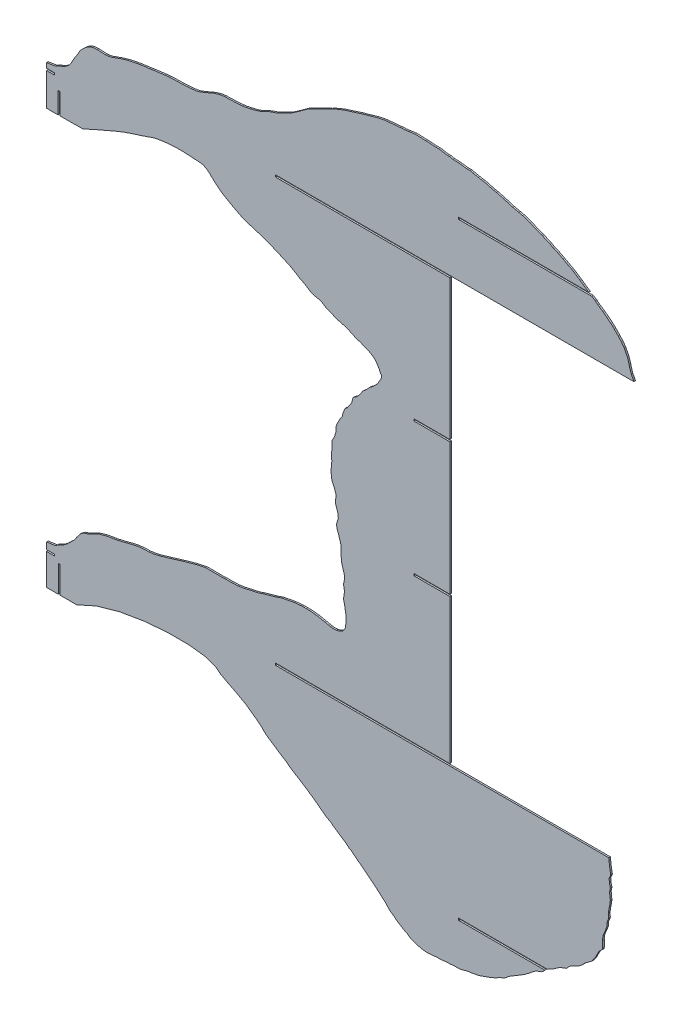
SolidWorks part; units mm, degrees
ref_plane "Спереди" through (0, 0, 0) normal (0, 0, 1) x (1, 0, 0)
ref_plane "Сверху" through (0, 0, 0) normal (0, 1, 0) x (1, 0, 0)
ref_plane "Справа" through (0, 0, 0) normal (1, 0, 0) x (0, 0, -1)
sketch "Model" plane through (0, 0, 0) normal (0, 0, 1) x (1, 0, 0)
  line L0 (-3659.4088, 337.2623) -> (-3649.3155, 337.2623)
  line L1 (-3649.3155, 337.2623) -> (-3649.3155, 339.2623)
  line L2 (-3649.3155, 339.2623) -> (-3659.4088, 339.2623)
  line L3 (-3659.4088, 339.2623) -> (-3659.4088, 347.0727)
  line L4 (-3659.4088, 347.0727) -> (-3659.15, 347.5463)
  line L5 (-3659.15, 347.5463) -> (-3647.8631, 349.1225)
  line L6 (-3647.8631, 349.1225) -> (-3646.4682, 350.2928)
  line L7 (-3646.4682, 350.2928) -> (-3646.1801, 350.5755)
  line L8 (-3646.1801, 350.5755) -> (-3644.035, 351.8111)
  line L9 (-3644.035, 351.8111) -> (-3640.8509, 353.3027)
  line L10 (-3640.8509, 353.3027) -> (-3638.1073, 355.0172)
  line L11 (-3638.1073, 355.0172) -> (-3637.5726, 355.2726)
  line L12 (-3637.5726, 355.2726) -> (-3637.2801, 355.5406)
  line L13 (-3637.2801, 355.5406) -> (-3635.3742, 356.9104)
  line L14 (-3635.3742, 356.9104) -> (-3635.3505, 356.9504)
  line L15 (-3635.3505, 356.9504) -> (-3632.9974, 358.7257)
  line L16 (-3632.9974, 358.7257) -> (-3631.9578, 360.0561)
  line L17 (-3631.9578, 360.0561) -> (-3630.5631, 361.0845)
  line L18 (-3630.5631, 361.0845) -> (-3629.7103, 361.911)
  line L19 (-3629.7103, 361.911) -> (-3629.6644, 362.1925)
  line L20 (-3629.6644, 362.1925) -> (-3625.4574, 366.0569)
  line L21 (-3625.4574, 366.0569) -> (-3625.409, 366.1805)
  line L22 (-3625.409, 366.1805) -> (-3622.3043, 370.4676)
  line L23 (-3622.3043, 370.4676) -> (-3621.7645, 371.2607)
  line L24 (-3621.7645, 371.2607) -> (-3621.5765, 371.5394)
  line L25 (-3621.5765, 371.5394) -> (-3621.3887, 371.8182)
  line L26 (-3621.3887, 371.8182) -> (-3621.0192, 372.2063)
  line L27 (-3621.0192, 372.2063) -> (-3617.6821, 376.6565)
  line L28 (-3617.6821, 376.6565) -> (-3615.281, 378.6078)
  line L29 (-3615.281, 378.6078) -> (-3613.1208, 380.0967)
  line L30 (-3613.1208, 380.0967) -> (-3608.8328, 381.5595)
  line L31 (-3608.8328, 381.5595) -> (-3604.8656, 383.1913)
  line L32 (-3604.8656, 383.1913) -> (-3602.0015, 384.5371)
  line L33 (-3602.0015, 384.5371) -> (-3597.7094, 386.8426)
  line L34 (-3597.7094, 386.8426) -> (-3595.8936, 387.7443)
  line L35 (-3595.8936, 387.7443) -> (-3592.8574, 389.0094)
  line L36 (-3592.8574, 389.0094) -> (-3585.2364, 391.0565)
  line L37 (-3585.2364, 391.0565) -> (-3585.1795, 391.0721)
  line L38 (-3585.1795, 391.0721) -> (-3585.1226, 391.0877)
  line L39 (-3585.1226, 391.0877) -> (-3584.9168, 391.1142)
  line L40 (-3584.9168, 391.1142) -> (-3577.4862, 392.5355)
  line L41 (-3577.4862, 392.5355) -> (-3575.5445, 392.7956)
  line L42 (-3575.5445, 392.7956) -> (-3573.322, 393.1171)
  line L43 (-3573.322, 393.1171) -> (-3570.3986, 393.6991)
  line L44 (-3570.3986, 393.6991) -> (-3568.5413, 394.2156)
  line L45 (-3568.5413, 394.2156) -> (-3561.6069, 395.7715)
  line L46 (-3561.6069, 395.7715) -> (-3560.2819, 396.0994)
  line L47 (-3560.2819, 396.0994) -> (-3559.4776, 396.3291)
  line L48 (-3559.4776, 396.3291) -> (-3551.2263, 398.491)
  line L49 (-3551.2263, 398.491) -> (-3550.5538, 398.6438)
  line L50 (-3550.5538, 398.6438) -> (-3547.3795, 399.2746)
  line L51 (-3547.3795, 399.2746) -> (-3546.0565, 399.5196)
  line L52 (-3546.0565, 399.5196) -> (-3543.9064, 399.7692)
  line L53 (-3543.9064, 399.7692) -> (-3539.775, 400.2472)
  line L54 (-3539.775, 400.2472) -> (-3531.8396, 400.5535)
  line L55 (-3531.8396, 400.5535) -> (-3527.8975, 400.968)
  line L56 (-3527.8975, 400.968) -> (-3525.4073, 401.3409)
  line L57 (-3525.4073, 401.3409) -> (-3520.2647, 402.5635)
  line L58 (-3520.2647, 402.5635) -> (-3518.7104, 402.8664)
  line L59 (-3518.7104, 402.8664) -> (-3517.6553, 403.1274)
  line L60 (-3517.6553, 403.1274) -> (-3511.9556, 404.8469)
  line L61 (-3511.9556, 404.8469) -> (-3506.9614, 406.2412)
  line L62 (-3506.9614, 406.2412) -> (-3498.2225, 408.9567)
  line L63 (-3498.2225, 408.9567) -> (-3496.8997, 409.4214)
  line L64 (-3496.8997, 409.4214) -> (-3491.8927, 410.8884)
  line L65 (-3491.8927, 410.8884) -> (-3491.0672, 411.0675)
  line L66 (-3491.0672, 411.0675) -> (-3488.8385, 411.8241)
  line L67 (-3488.8385, 411.8241) -> (-3483.442, 413.3824)
  line L68 (-3483.442, 413.3824) -> (-3478.422, 414.7273)
  line L69 (-3478.422, 414.7273) -> (-3472.647, 416.3851)
  line L70 (-3472.647, 416.3851) -> (-3471.3883, 416.6549)
  line L71 (-3471.3883, 416.6549) -> (-3461.5572, 418.7129)
  line L72 (-3461.5572, 418.7129) -> (-3461.0606, 418.8202)
  line L73 (-3461.0606, 418.8202) -> (-3460.6243, 418.8555)
  line L74 (-3460.6243, 418.8555) -> (-3452.8575, 418.8324)
  line L75 (-3452.8575, 418.8324) -> (-3445.1597, 418.7839)
  line L76 (-3445.1597, 418.7839) -> (-3441.9923, 418.7149)
  line L77 (-3441.9923, 418.7149) -> (-3439.0233, 418.7909)
  line L78 (-3439.0233, 418.7909) -> (-3437.056, 418.9925)
  line L79 (-3437.056, 418.9925) -> (-3431.6905, 418.9816)
  line L80 (-3431.6905, 418.9816) -> (-3429.2882, 418.8589)
  line L81 (-3429.2882, 418.8589) -> (-3427.9578, 418.9259)
  line L82 (-3427.9578, 418.9259) -> (-3424.1756, 419.1709)
  line L83 (-3424.1756, 419.1709) -> (-3421.4486, 419.2988)
  line L84 (-3421.4486, 419.2988) -> (-3420.5516, 419.3881)
  line L85 (-3420.5516, 419.3881) -> (-3419.4176, 419.5984)
  line L86 (-3419.4176, 419.5984) -> (-3413.984, 420.3053)
  line L87 (-3413.984, 420.3053) -> (-3408.2791, 421.6846)
  line L88 (-3408.2791, 421.6846) -> (-3408.253, 421.69)
  line L89 (-3408.253, 421.69) -> (-3408.2269, 421.6954)
  line L90 (-3408.2269, 421.6954) -> (-3408.1771, 421.7132)
  line L91 (-3408.1771, 421.7132) -> (-3408.13, 421.7249)
  line L92 (-3408.13, 421.7249) -> (-3403.4, 422.847)
  line L93 (-3403.4, 422.847) -> (-3401.0462, 423.1767)
  line L94 (-3401.0462, 423.1767) -> (-3398.1966, 423.8763)
  line L95 (-3398.1966, 423.8763) -> (-3394.6744, 424.7099)
  line L96 (-3394.6744, 424.7099) -> (-3390.1671, 426.2731)
  line L97 (-3390.1671, 426.2731) -> (-3389.9757, 426.3233)
  line L98 (-3389.9757, 426.3233) -> (-3389.7843, 426.3735)
  line L99 (-3389.7843, 426.3735) -> (-3389.6265, 426.4156)
  line L100 (-3389.6265, 426.4156) -> (-3389.4688, 426.4576)
  line L101 (-3389.4688, 426.4576) -> (-3382.1798, 428.6192)
  line L102 (-3382.1798, 428.6192) -> (-3380.5787, 429.0409)
  line L103 (-3380.5787, 429.0409) -> (-3374.8822, 430.6557)
  line L104 (-3374.8822, 430.6557) -> (-3371.9735, 431.5056)
  line L105 (-3371.9735, 431.5056) -> (-3369.5433, 432.4494)
  line L106 (-3369.5433, 432.4494) -> (-3366.4566, 433.4155)
  line L107 (-3366.4566, 433.4155) -> (-3364.357, 433.9945)
  line L108 (-3364.357, 433.9945) -> (-3360.9254, 434.5253)
  line L109 (-3360.9254, 434.5253) -> (-3352.9075, 436.1205)
  line L110 (-3352.9075, 436.1205) -> (-3350.255, 436.5114)
  line L111 (-3350.255, 436.5114) -> (-3344.5418, 437.0877)
  line L112 (-3344.5418, 437.0877) -> (-3341.8287, 437.3396)
  line L113 (-3341.8287, 437.3396) -> (-3340.596, 437.3971)
  line L114 (-3340.596, 437.3971) -> (-3335.0216, 437.4364)
  line L115 (-3335.0216, 437.4364) -> (-3330.9464, 437.28)
  line L116 (-3330.9464, 437.28) -> (-3326.0731, 436.8271)
  line L117 (-3326.0731, 436.8271) -> (-3321.4552, 436.3248)
  line L118 (-3321.4552, 436.3248) -> (-3312.8116, 434.5679)
  line L119 (-3312.8116, 434.5679) -> (-3308.004, 433.5045)
  line L120 (-3308.004, 433.5045) -> (-3305.5709, 432.9001)
  line L121 (-3305.5709, 432.9001) -> (-3304.4671, 432.9049)
  line L122 (-3304.4671, 432.9049) -> (-3302.5904, 432.6146)
  line L123 (-3302.5904, 432.6146) -> (-3298.4105, 432.7226)
  line L124 (-3298.4105, 432.7226) -> (-3298.3045, 432.7126)
  line L125 (-3298.3045, 432.7126) -> (-3298.1986, 432.7124)
  line L126 (-3298.1986, 432.7124) -> (-3295.7388, 433.4062)
  line L127 (-3295.7388, 433.4062) -> (-3295.0428, 433.5812)
  line L128 (-3295.0428, 433.5812) -> (-3293.192, 434.3278)
  line L129 (-3293.192, 434.3278) -> (-3290.2706, 436.0132)
  line L130 (-3290.2706, 436.0132) -> (-3290.0604, 436.2078)
  line L131 (-3290.0604, 436.2078) -> (-3289.981, 436.3371)
  line L132 (-3289.981, 436.3371) -> (-3289.9019, 436.4664)
  line L133 (-3289.9019, 436.4664) -> (-3288.0821, 438.7803)
  line L134 (-3288.0821, 438.7803) -> (-3287.0845, 440.5862)
  line L135 (-3287.0845, 440.5862) -> (-3286.7364, 442.4386)
  line L136 (-3286.7364, 442.4386) -> (-3286.4866, 445.0603)
  line L137 (-3286.4866, 445.0603) -> (-3286.3692, 445.7683)
  line L138 (-3286.3692, 445.7683) -> (-3286.2518, 446.4763)
  line L139 (-3286.2518, 446.4763) -> (-3286.1373, 446.9131)
  line L140 (-3286.1373, 446.9131) -> (-3286.1268, 447.0846)
  line L141 (-3286.1268, 447.0846) -> (-3286.1165, 447.2561)
  line L142 (-3286.1165, 447.2561) -> (-3286.0177, 448.2623)
  line L143 (-3286.0177, 448.2623) -> (-3285.8695, 449.9895)
  line L144 (-3285.8695, 449.9895) -> (-3285.8734, 450.7023)
  line L145 (-3285.8734, 450.7023) -> (-3285.8775, 451.415)
  line L146 (-3285.8775, 451.415) -> (-3286.4085, 456.209)
  line L147 (-3286.4085, 456.209) -> (-3286.5682, 457.0887)
  line L148 (-3286.5682, 457.0887) -> (-3286.7279, 457.9685)
  line L149 (-3286.7279, 457.9685) -> (-3287.5396, 463.1307)
  line L150 (-3287.5396, 463.1307) -> (-3287.6644, 463.8354)
  line L151 (-3287.6644, 463.8354) -> (-3289.1263, 470.3016)
  line L152 (-3289.1263, 470.3016) -> (-3289.1683, 471.0357)
  line L153 (-3289.1683, 471.0357) -> (-3289.2103, 471.7697)
  line L154 (-3289.2103, 471.7697) -> (-3289.211, 471.8312)
  line L155 (-3289.211, 471.8312) -> (-3289.1859, 471.8983)
  line L156 (-3289.1859, 471.8983) -> (-3289.1607, 471.9655)
  line L157 (-3289.1607, 471.9655) -> (-3288.2274, 478.2117)
  line L158 (-3288.2274, 478.2117) -> (-3288.3211, 481.2084)
  line L159 (-3288.3211, 481.2084) -> (-3289.1314, 486.151)
  line L160 (-3289.1314, 486.151) -> (-3289.0694, 486.6238)
  line L161 (-3289.0694, 486.6238) -> (-3289.0074, 487.0965)
  line L162 (-3289.0074, 487.0965) -> (-3288.9803, 488.2449)
  line L163 (-3288.9803, 488.2449) -> (-3288.9534, 489.3932)
  line L164 (-3288.9534, 489.3932) -> (-3288.377, 490.986)
  line L165 (-3288.377, 490.986) -> (-3288.2838, 491.6988)
  line L166 (-3288.2838, 491.6988) -> (-3288.2847, 492.9639)
  line L167 (-3288.2847, 492.9639) -> (-3287.9085, 495.7334)
  line L168 (-3287.9085, 495.7334) -> (-3288.4552, 498.5319)
  line L169 (-3288.4552, 498.5319) -> (-3289.7574, 502.7495)
  line L170 (-3289.7574, 502.7495) -> (-3290.0123, 503.6582)
  line L171 (-3290.0123, 503.6582) -> (-3290.2672, 504.567)
  line L172 (-3290.2672, 504.567) -> (-3290.6309, 505.4973)
  line L173 (-3290.6309, 505.4973) -> (-3290.9947, 506.4277)
  line L174 (-3290.9947, 506.4277) -> (-3291.5194, 509.0262)
  line L175 (-3291.5194, 509.0262) -> (-3291.9017, 512.7728)
  line L176 (-3291.9017, 512.7728) -> (-3292.0426, 513.9631)
  line L177 (-3292.0426, 513.9631) -> (-3292.1837, 515.1535)
  line L178 (-3292.1837, 515.1535) -> (-3292.3988, 521.6939)
  line L179 (-3292.3988, 521.6939) -> (-3292.3992, 525.126)
  line L180 (-3292.3992, 525.126) -> (-3292.7205, 528.4976)
  line L181 (-3292.7205, 528.4976) -> (-3292.868, 529.2128)
  line L182 (-3292.868, 529.2128) -> (-3293.0155, 529.928)
  line L183 (-3293.0155, 529.928) -> (-3293.8077, 532.2159)
  line L184 (-3293.8077, 532.2159) -> (-3294.9315, 535.9393)
  line L185 (-3294.9315, 535.9393) -> (-3295.3668, 537.6521)
  line L186 (-3295.3668, 537.6521) -> (-3297.4005, 542.8596)
  line L187 (-3297.4005, 542.8596) -> (-3297.8387, 545.6981)
  line L188 (-3297.8387, 545.6981) -> (-3297.9193, 546.8756)
  line L189 (-3297.9193, 546.8756) -> (-3297.2691, 550.3362)
  line L190 (-3297.2691, 550.3362) -> (-3296.1248, 553.7305)
  line L191 (-3296.1248, 553.7305) -> (-3295.9139, 554.3348)
  line L192 (-3295.9139, 554.3348) -> (-3295.703, 554.9392)
  line L193 (-3295.703, 554.9392) -> (-3296.2838, 559.1301)
  line L194 (-3296.2838, 559.1301) -> (-3296.2635, 560.0077)
  line L195 (-3296.2635, 560.0077) -> (-3296.293, 560.2726)
  line L196 (-3296.293, 560.2726) -> (-3299.1519, 568.9351)
  line L197 (-3299.1519, 568.9351) -> (-3299.2755, 569.3047)
  line L198 (-3299.2755, 569.3047) -> (-3299.2767, 569.3159)
  line L199 (-3299.2767, 569.3159) -> (-3299.2782, 569.3272)
  line L200 (-3299.2782, 569.3272) -> (-3299.2747, 569.3801)
  line L201 (-3299.2747, 569.3801) -> (-3299.2713, 569.433)
  line L202 (-3299.2713, 569.433) -> (-3299.1732, 574.0535)
  line L203 (-3299.1732, 574.0535) -> (-3299.0118, 574.3897)
  line L204 (-3299.0118, 574.3897) -> (-3298.8504, 574.7258)
  line L205 (-3298.8504, 574.7258) -> (-3298.4647, 578.0221)
  line L206 (-3298.4647, 578.0221) -> (-3298.4412, 578.593)
  line L207 (-3298.4412, 578.593) -> (-3299.8748, 582.7346)
  line L208 (-3299.8748, 582.7346) -> (-3299.9605, 583.1378)
  line L209 (-3299.9605, 583.1378) -> (-3300.0465, 583.541)
  line L210 (-3300.0465, 583.541) -> (-3303.6085, 591.5479)
  line L211 (-3303.6085, 591.5479) -> (-3303.8116, 592.3677)
  line L212 (-3303.8116, 592.3677) -> (-3304.015, 593.1875)
  line L213 (-3304.015, 593.1875) -> (-3304.2962, 594.9847)
  line L214 (-3304.2962, 594.9847) -> (-3304.7821, 601.4762)
  line L215 (-3304.7821, 601.4762) -> (-3304.6607, 603.6652)
  line L216 (-3304.6607, 603.6652) -> (-3304.1312, 608.1517)
  line L217 (-3304.1312, 608.1517) -> (-3303.8829, 612.1683)
  line L218 (-3303.8829, 612.1683) -> (-3303.9595, 614.127)
  line L219 (-3303.9595, 614.127) -> (-3304.1243, 616.8857)
  line L220 (-3304.1243, 616.8857) -> (-3303.9539, 618.0922)
  line L221 (-3303.9539, 618.0922) -> (-3303.9539, 618.4237)
  line L222 (-3303.9539, 618.4237) -> (-3303.9539, 618.7551)
  line L223 (-3303.9539, 618.7551) -> (-3303.9288, 623.5233)
  line L224 (-3303.9288, 623.5233) -> (-3303.4842, 626.4954)
  line L225 (-3303.4842, 626.4954) -> (-3303.9464, 630.7457)
  line L226 (-3303.9464, 630.7457) -> (-3303.8768, 631.8074)
  line L227 (-3303.8768, 631.8074) -> (-3303.868, 632.5643)
  line L228 (-3303.868, 632.5643) -> (-3303.8592, 633.3213)
  line L229 (-3303.8592, 633.3213) -> (-3303.5899, 634.428)
  line L230 (-3303.5899, 634.428) -> (-3303.3209, 635.5347)
  line L231 (-3303.3209, 635.5347) -> (-3301.1346, 639.1162)
  line L232 (-3301.1346, 639.1162) -> (-3300.7923, 639.759)
  line L233 (-3300.7923, 639.759) -> (-3300.4503, 640.4017)
  line L234 (-3300.4503, 640.4017) -> (-3300.1502, 641.4346)
  line L235 (-3300.1502, 641.4346) -> (-3299.8658, 642.6189)
  line L236 (-3299.8658, 642.6189) -> (-3298.7037, 646.5537)
  line L237 (-3298.7037, 646.5537) -> (-3298.8087, 648.1917)
  line L238 (-3298.8087, 648.1917) -> (-3298.7528, 651.0909)
  line L239 (-3298.7528, 651.0909) -> (-3298.1815, 654.047)
  line L240 (-3298.1815, 654.047) -> (-3297.7955, 654.6354)
  line L241 (-3297.7955, 654.6354) -> (-3297.4095, 655.2239)
  line L242 (-3297.4095, 655.2239) -> (-3297.0513, 656.4668)
  line L243 (-3297.0513, 656.4668) -> (-3295.2716, 659.7721)
  line L244 (-3295.2716, 659.7721) -> (-3294.9403, 660.5859)
  line L245 (-3294.9403, 660.5859) -> (-3293.9227, 662.4513)
  line L246 (-3293.9227, 662.4513) -> (-3293.449, 663.5491)
  line L247 (-3293.449, 663.5491) -> (-3291.3519, 666.3707)
  line L248 (-3291.3519, 666.3707) -> (-3290.6597, 667.2816)
  line L249 (-3290.6597, 667.2816) -> (-3290.566, 667.9143)
  line L250 (-3290.566, 667.9143) -> (-3290.0118, 671.2581)
  line L251 (-3290.0118, 671.2581) -> (-3288.2508, 675.3898)
  line L252 (-3288.2508, 675.3898) -> (-3287.9769, 676.1389)
  line L253 (-3287.9769, 676.1389) -> (-3287.703, 676.8879)
  line L254 (-3287.703, 676.8879) -> (-3287.596, 677.1597)
  line L255 (-3287.596, 677.1597) -> (-3287.4891, 677.4314)
  line L256 (-3287.4891, 677.4314) -> (-3285.8311, 678.5922)
  line L257 (-3285.8311, 678.5922) -> (-3284.6109, 679.4458)
  line L258 (-3284.6109, 679.4458) -> (-3283.7684, 680.897)
  line L259 (-3283.7684, 680.897) -> (-3282.9823, 682.2129)
  line L260 (-3282.9823, 682.2129) -> (-3282.0411, 683.3925)
  line L261 (-3282.0411, 683.3925) -> (-3280.0972, 686.2822)
  line L262 (-3280.0972, 686.2822) -> (-3279.3026, 687.7454)
  line L263 (-3279.3026, 687.7454) -> (-3278.6788, 689.0056)
  line L264 (-3278.6788, 689.0056) -> (-3278.2823, 691.4264)
  line L265 (-3278.2823, 691.4264) -> (-3278.0636, 692.3671)
  line L266 (-3278.0636, 692.3671) -> (-3277.2506, 694.4464)
  line L267 (-3277.2506, 694.4464) -> (-3276.8765, 694.7518)
  line L268 (-3276.8765, 694.7518) -> (-3276.5028, 695.0573)
  line L269 (-3276.5028, 695.0573) -> (-3273.807, 696.7064)
  line L270 (-3273.807, 696.7064) -> (-3272.2908, 698.0122)
  line L271 (-3272.2908, 698.0122) -> (-3269.5076, 701.1151)
  line L272 (-3269.5076, 701.1151) -> (-3269.168, 701.4777)
  line L273 (-3269.168, 701.4777) -> (-3268.8287, 701.8403)
  line L274 (-3268.8287, 701.8403) -> (-3267.7982, 703.2976)
  line L275 (-3267.7982, 703.2976) -> (-3265.567, 706.9701)
  line L276 (-3265.567, 706.9701) -> (-3264.3548, 708.0449)
  line L277 (-3264.3548, 708.0449) -> (-3261.1759, 710.6555)
  line L278 (-3261.1759, 710.6555) -> (-3258.0545, 714.1406)
  line L279 (-3258.0545, 714.1406) -> (-3257.8165, 714.4504)
  line L280 (-3257.8165, 714.4504) -> (-3257.5787, 714.7603)
  line L281 (-3257.5787, 714.7603) -> (-3257.3382, 714.9592)
  line L282 (-3257.3382, 714.9592) -> (-3257.098, 715.1581)
  line L283 (-3257.098, 715.1581) -> (-3256.7957, 715.4345)
  line L284 (-3256.7957, 715.4345) -> (-3256.4937, 715.7108)
  line L285 (-3256.4937, 715.7108) -> (-3252.5233, 718.6021)
  line L286 (-3252.5233, 718.6021) -> (-3248.8912, 722.4143)
  line L287 (-3248.8912, 722.4143) -> (-3247.3201, 723.8026)
  line L288 (-3247.3201, 723.8026) -> (-3245.9958, 725.8405)
  line L289 (-3245.9958, 725.8405) -> (-3245.2092, 727.6705)
  line L290 (-3245.2092, 727.6705) -> (-3243.5615, 730.1585)
  line L291 (-3243.5615, 730.1585) -> (-3243.134, 730.8071)
  line L292 (-3243.134, 730.8071) -> (-3242.7065, 731.4558)
  line L293 (-3242.7065, 731.4558) -> (-3242.0099, 733.3641)
  line L294 (-3242.0099, 733.3641) -> (-3241.9269, 733.6895)
  line L295 (-3241.9269, 733.6895) -> (-3241.8515, 734.2061)
  line L296 (-3241.8515, 734.2061) -> (-3241.7763, 734.7227)
  line L297 (-3241.7763, 734.7227) -> (-3241.8591, 734.9879)
  line L298 (-3241.8591, 734.9879) -> (-3241.9206, 735.3684)
  line L299 (-3241.9206, 735.3684) -> (-3241.8547, 735.8762)
  line L300 (-3241.8547, 735.8762) -> (-3242.0375, 736.2616)
  line L301 (-3242.0375, 736.2616) -> (-3242.5737, 736.7289)
  line L302 (-3242.5737, 736.7289) -> (-3244.0129, 738.9802)
  line L303 (-3244.0129, 738.9802) -> (-3244.1408, 739.5122)
  line L304 (-3244.1408, 739.5122) -> (-3244.269, 740.0442)
  line L305 (-3244.269, 740.0442) -> (-3244.6142, 740.8704)
  line L306 (-3244.6142, 740.8704) -> (-3244.9594, 741.6967)
  line L307 (-3244.9594, 741.6967) -> (-3245.9213, 743.0676)
  line L308 (-3245.9213, 743.0676) -> (-3245.9438, 743.2604)
  line L309 (-3245.9438, 743.2604) -> (-3245.9662, 743.4531)
  line L310 (-3245.9662, 743.4531) -> (-3247.2288, 745.085)
  line L311 (-3247.2288, 745.085) -> (-3247.4561, 745.5867)
  line L312 (-3247.4561, 745.5867) -> (-3247.6837, 746.0885)
  line L313 (-3247.6837, 746.0885) -> (-3249.544, 748.7163)
  line L314 (-3249.544, 748.7163) -> (-3253.4732, 751.6041)
  line L315 (-3253.4732, 751.6041) -> (-3253.4757, 751.606)
  line L316 (-3253.4757, 751.606) -> (-3253.4835, 751.6101)
  line L317 (-3253.4835, 751.6101) -> (-3257.6417, 754.1653)
  line L318 (-3257.6417, 754.1653) -> (-3262.1629, 755.7285)
  line L319 (-3262.1629, 755.7285) -> (-3262.3995, 755.7892)
  line L320 (-3262.3995, 755.7892) -> (-3262.6361, 755.8499)
  line L321 (-3262.6361, 755.8499) -> (-3263.9842, 756.4589)
  line L322 (-3263.9842, 756.4589) -> (-3265.1583, 757.1176)
  line L323 (-3265.1583, 757.1176) -> (-3265.3277, 757.1771)
  line L324 (-3265.3277, 757.1771) -> (-3265.4971, 757.2367)
  line L325 (-3265.4971, 757.2367) -> (-3267.7598, 758.3345)
  line L326 (-3267.7598, 758.3345) -> (-3267.8023, 758.3399)
  line L327 (-3267.8023, 758.3399) -> (-3267.8448, 758.3452)
  line L328 (-3267.8448, 758.3452) -> (-3267.9554, 758.3641)
  line L329 (-3267.9554, 758.3641) -> (-3268.0662, 758.3831)
  line L330 (-3268.0662, 758.3831) -> (-3270.1812, 759.0607)
  line L331 (-3270.1812, 759.0607) -> (-3273.4439, 759.9802)
  line L332 (-3273.4439, 759.9802) -> (-3273.6295, 760.0104)
  line L333 (-3273.6295, 760.0104) -> (-3278.2227, 762.4507)
  line L334 (-3278.2227, 762.4507) -> (-3280.8057, 763.4719)
  line L335 (-3280.8057, 763.4719) -> (-3281.1295, 763.6698)
  line L336 (-3281.1295, 763.6698) -> (-3281.3311, 763.739)
  line L337 (-3281.3311, 763.739) -> (-3281.4625, 763.7821)
  line L338 (-3281.4625, 763.7821) -> (-3281.5938, 763.8252)
  line L339 (-3281.5938, 763.8252) -> (-3283.2899, 764.5444)
  line L340 (-3283.2899, 764.5444) -> (-3286.849, 766.1364)
  line L341 (-3286.849, 766.1364) -> (-3287.5362, 766.2044)
  line L342 (-3287.5362, 766.2044) -> (-3288.2559, 766.3848)
  line L343 (-3288.2559, 766.3848) -> (-3291.9708, 767.3807)
  line L344 (-3291.9708, 767.3807) -> (-3295.4251, 768.2042)
  line L345 (-3295.4251, 768.2042) -> (-3296.5272, 768.5413)
  line L346 (-3296.5272, 768.5413) -> (-3300.2991, 769.955)
  line L347 (-3300.2991, 769.955) -> (-3302.3817, 770.8872)
  line L348 (-3302.3817, 770.8872) -> (-3305.3765, 772.4581)
  line L349 (-3305.3765, 772.4581) -> (-3310.0709, 773.8463)
  line L350 (-3310.0709, 773.8463) -> (-3310.1431, 773.8709)
  line L351 (-3310.1431, 773.8709) -> (-3314.9315, 777.0049)
  line L352 (-3314.9315, 777.0049) -> (-3315.1859, 777.1483)
  line L353 (-3315.1859, 777.1483) -> (-3315.4403, 777.2916)
  line L354 (-3315.4403, 777.2916) -> (-3317.6864, 778.3079)
  line L355 (-3317.6864, 778.3079) -> (-3320.7918, 779.2971)
  line L356 (-3320.7918, 779.2971) -> (-3320.8267, 779.312)
  line L357 (-3320.8267, 779.312) -> (-3320.8619, 779.3269)
  line L358 (-3320.8619, 779.3269) -> (-3320.8863, 779.3302)
  line L359 (-3320.8863, 779.3302) -> (-3320.9107, 779.3335)
  line L360 (-3320.9107, 779.3335) -> (-3324.909, 780.0305)
  line L361 (-3324.909, 780.0305) -> (-3325.6712, 780.1598)
  line L362 (-3325.6712, 780.1598) -> (-3328.4002, 780.927)
  line L363 (-3328.4002, 780.927) -> (-3329.2103, 781.4102)
  line L364 (-3329.2103, 781.4102) -> (-3331.5672, 782.679)
  line L365 (-3331.5672, 782.679) -> (-3334.608, 784.7333)
  line L366 (-3334.608, 784.7333) -> (-3336.3646, 785.9934)
  line L367 (-3336.3646, 785.9934) -> (-3338.3443, 787.0547)
  line L368 (-3338.3443, 787.0547) -> (-3344.4989, 790.1213)
  line L369 (-3344.4989, 790.1213) -> (-3348.366, 792.7183)
  line L370 (-3348.366, 792.7183) -> (-3352.0919, 794.8547)
  line L371 (-3352.0919, 794.8547) -> (-3357.2703, 797.7913)
  line L372 (-3357.2703, 797.7913) -> (-3363.6226, 800.3911)
  line L373 (-3363.6226, 800.3911) -> (-3363.7108, 800.4222)
  line L374 (-3363.7108, 800.4222) -> (-3370.304, 803.5359)
  line L375 (-3370.304, 803.5359) -> (-3370.6639, 803.6913)
  line L376 (-3370.6639, 803.6913) -> (-3370.9935, 803.8199)
  line L377 (-3370.9935, 803.8199) -> (-3371.3231, 803.9485)
  line L378 (-3371.3231, 803.9485) -> (-3381.347, 808.0862)
  line L379 (-3381.347, 808.0862) -> (-3383.9945, 809.0479)
  line L380 (-3383.9945, 809.0479) -> (-3390.9222, 811.6316)
  line L381 (-3390.9222, 811.6316) -> (-3398.2713, 813.9082)
  line L382 (-3398.2713, 813.9082) -> (-3407.9417, 816.9002)
  line L383 (-3407.9417, 816.9002) -> (-3414.3045, 819.1515)
  line L384 (-3414.3045, 819.1515) -> (-3415.0643, 819.4529)
  line L385 (-3415.0643, 819.4529) -> (-3415.512, 819.652)
  line L386 (-3415.512, 819.652) -> (-3416.5509, 820.1542)
  line L387 (-3416.5509, 820.1542) -> (-3423.0863, 823.4036)
  line L388 (-3423.0863, 823.4036) -> (-3429.8287, 827.0191)
  line L389 (-3429.8287, 827.0191) -> (-3434.5516, 829.7068)
  line L390 (-3434.5516, 829.7068) -> (-3438.0753, 831.8914)
  line L391 (-3438.0753, 831.8914) -> (-3443.1605, 835.229)
  line L392 (-3443.1605, 835.229) -> (-3443.8228, 835.7111)
  line L393 (-3443.8228, 835.7111) -> (-3448.0802, 839.1972)
  line L394 (-3448.0802, 839.1972) -> (-3454.4495, 845.062)
  line L395 (-3454.4495, 845.062) -> (-3457.4896, 847.9663)
  line L396 (-3457.4896, 847.9663) -> (-3460.776, 850.2266)
  line L397 (-3460.776, 850.2266) -> (-3461.0572, 850.4297)
  line L398 (-3461.0572, 850.4297) -> (-3461.1978, 850.4887)
  line L399 (-3461.1978, 850.4887) -> (-3461.3385, 850.5477)
  line L400 (-3461.3385, 850.5477) -> (-3462.8902, 851.1951)
  line L401 (-3462.8902, 851.1951) -> (-3464.6693, 851.9994)
  line L402 (-3464.6693, 851.9994) -> (-3464.7684, 852.0405)
  line L403 (-3464.7684, 852.0405) -> (-3464.8678, 852.0816)
  line L404 (-3464.8678, 852.0816) -> (-3466.9093, 852.3552)
  line L405 (-3466.9093, 852.3552) -> (-3468.0477, 852.5371)
  line L406 (-3468.0477, 852.5371) -> (-3468.1446, 852.5561)
  line L407 (-3468.1446, 852.5561) -> (-3468.2418, 852.5751)
  line L408 (-3468.2418, 852.5751) -> (-3469.6773, 852.6567)
  line L409 (-3469.6773, 852.6567) -> (-3489.7198, 853.8401)
  line L410 (-3489.7198, 853.8401) -> (-3492.774, 853.7993)
  line L411 (-3492.774, 853.7993) -> (-3497.9481, 853.8388)
  line L412 (-3497.9481, 853.8388) -> (-3500.9335, 853.6661)
  line L413 (-3500.9335, 853.6661) -> (-3505.2528, 853.3816)
  line L414 (-3505.2528, 853.3816) -> (-3513.0054, 852.5294)
  line L415 (-3513.0054, 852.5294) -> (-3514.4254, 852.4082)
  line L416 (-3514.4254, 852.4082) -> (-3516.0228, 852.1261)
  line L417 (-3516.0228, 852.1261) -> (-3521.453, 851.2953)
  line L418 (-3521.453, 851.2953) -> (-3525.514, 850.2896)
  line L419 (-3525.514, 850.2896) -> (-3528.2471, 849.4955)
  line L420 (-3528.2471, 849.4955) -> (-3533.7718, 847.5649)
  line L421 (-3533.7718, 847.5649) -> (-3541.2449, 845.0394)
  line L422 (-3541.2449, 845.0394) -> (-3552.2575, 841.4723)
  line L423 (-3552.2575, 841.4723) -> (-3553.265, 841.1592)
  line L424 (-3553.265, 841.1592) -> (-3554.1062, 840.8693)
  line L425 (-3554.1062, 840.8693) -> (-3562.8416, 837.9146)
  line L426 (-3562.8416, 837.9146) -> (-3564.9625, 837.0508)
  line L427 (-3564.9625, 837.0508) -> (-3574.9366, 833.1111)
  line L428 (-3574.9366, 833.1111) -> (-3585.1458, 828.5784)
  line L429 (-3585.1458, 828.5784) -> (-3585.6634, 828.3682)
  line L430 (-3585.6634, 828.3682) -> (-3586.254, 828.1343)
  line L431 (-3586.254, 828.1343) -> (-3599.0191, 822.6442)
  line L432 (-3599.0191, 822.6442) -> (-3601.8382, 821.5305)
  line L433 (-3601.8382, 821.5305) -> (-3608.5824, 818.2112)
  line L434 (-3608.5824, 818.2112) -> (-3610.5816, 817.349)
  line L435 (-3610.5816, 817.349) -> (-3614.3665, 815.8294)
  line L436 (-3614.3665, 815.8294) -> (-3642.4041, 815.5363)
  line L437 (-3642.4041, 815.5363) -> (-3642.4041, 841.861)
  line L438 (-3642.4041, 841.861) -> (-3642.6541, 841.861)
  line L439 (-3642.6541, 841.861) -> (-3644.6541, 841.861)
  line L440 (-3644.6541, 841.861) -> (-3644.9041, 841.861)
  line L441 (-3644.9041, 841.861) -> (-3644.9041, 815.5121)
  line L442 (-3644.9041, 815.5121) -> (-3659.3858, 815.4688)
  line L443 (-3659.3858, 815.4688) -> (-3659.3858, 856.2086)
  line L444 (-3659.3858, 856.2086) -> (-3649.316, 856.2086)
  line L445 (-3649.316, 856.2086) -> (-3649.316, 856.4586)
  line L446 (-3649.316, 856.4586) -> (-3649.316, 858.4586)
  line L447 (-3649.316, 858.4586) -> (-3649.316, 858.7086)
  line L448 (-3649.316, 858.7086) -> (-3659.3858, 858.7086)
  line L449 (-3659.3858, 858.7086) -> (-3659.3858, 864.7969)
  line L450 (-3659.3858, 864.7969) -> (-3647.9893, 866.4534)
  line L451 (-3647.9893, 866.4534) -> (-3647.8953, 866.593)
  line L452 (-3647.8953, 866.593) -> (-3647.6441, 866.8042)
  line L453 (-3647.6441, 866.8042) -> (-3645.7834, 868.0435)
  line L454 (-3645.7834, 868.0435) -> (-3644.0457, 868.8997)
  line L455 (-3644.0457, 868.8997) -> (-3640.8592, 870.0783)
  line L456 (-3640.8592, 870.0783) -> (-3638.7601, 870.9019)
  line L457 (-3638.7601, 870.9019) -> (-3636.629, 872.0472)
  line L458 (-3636.629, 872.0472) -> (-3634.2489, 873.5946)
  line L459 (-3634.2489, 873.5946) -> (-3631.9635, 875.3132)
  line L460 (-3631.9635, 875.3132) -> (-3631.1352, 876.1233)
  line L461 (-3631.1352, 876.1233) -> (-3629.5645, 878.2477)
  line L462 (-3629.5645, 878.2477) -> (-3628.9544, 878.8694)
  line L463 (-3628.9544, 878.8694) -> (-3626.8436, 883.0201)
  line L464 (-3626.8436, 883.0201) -> (-3624.7706, 886.6925)
  line L465 (-3624.7706, 886.6925) -> (-3621.5199, 891.5044)
  line L466 (-3621.5199, 891.5044) -> (-3620.9991, 892.5305)
  line L467 (-3620.9991, 892.5305) -> (-3617.6552, 898.2273)
  line L468 (-3617.6552, 898.2273) -> (-3616.7344, 899.4209)
  line L469 (-3616.7344, 899.4209) -> (-3614.7832, 901.4733)
  line L470 (-3614.7832, 901.4733) -> (-3611.5046, 904.5562)
  line L471 (-3611.5046, 904.5562) -> (-3608.7801, 906.7772)
  line L472 (-3608.7801, 906.7772) -> (-3607.237, 907.6827)
  line L473 (-3607.237, 907.6827) -> (-3605.7431, 908.3713)
  line L474 (-3605.7431, 908.3713) -> (-3604.0188, 909.3092)
  line L475 (-3604.0188, 909.3092) -> (-3601.7493, 909.9563)
  line L476 (-3601.7493, 909.9563) -> (-3600.7467, 910.1682)
  line L477 (-3600.7467, 910.1682) -> (-3596.7349, 910.4182)
  line L478 (-3596.7349, 910.4182) -> (-3596.1116, 910.4482)
  line L479 (-3596.1116, 910.4482) -> (-3594.8358, 910.4113)
  line L480 (-3594.8358, 910.4113) -> (-3586.4615, 909.9118)
  line L481 (-3586.4615, 909.9118) -> (-3584.7601, 910.0518)
  line L482 (-3584.7601, 910.0518) -> (-3583.7032, 910.0595)
  line L483 (-3583.7032, 910.0595) -> (-3581.951, 910.3115)
  line L484 (-3581.951, 910.3115) -> (-3578.7935, 910.9379)
  line L485 (-3578.7935, 910.9379) -> (-3575.3807, 912.1852)
  line L486 (-3575.3807, 912.1852) -> (-3572.1094, 913.3336)
  line L487 (-3572.1094, 913.3336) -> (-3565.0184, 915.7952)
  line L488 (-3565.0184, 915.7952) -> (-3558.1956, 917.7784)
  line L489 (-3558.1956, 917.7784) -> (-3555.8431, 918.3431)
  line L490 (-3555.8431, 918.3431) -> (-3548.345, 919.8879)
  line L491 (-3548.345, 919.8879) -> (-3545.3575, 920.4164)
  line L492 (-3545.3575, 920.4164) -> (-3542.3709, 920.8733)
  line L493 (-3542.3709, 920.8733) -> (-3534.6871, 922.0118)
  line L494 (-3534.6871, 922.0118) -> (-3530.795, 922.4594)
  line L495 (-3530.795, 922.4594) -> (-3526.5269, 923.1776)
  line L496 (-3526.5269, 923.1776) -> (-3512.223, 925.0082)
  line L497 (-3512.223, 925.0082) -> (-3511.2288, 925.1937)
  line L498 (-3511.2288, 925.1937) -> (-3508.8919, 925.4513)
  line L499 (-3508.8919, 925.4513) -> (-3507.5035, 925.5681)
  line L500 (-3507.5035, 925.5681) -> (-3506.0799, 925.6306)
  line L501 (-3506.0799, 925.6306) -> (-3496.6702, 926.0156)
  line L502 (-3496.6702, 926.0156) -> (-3489.9332, 926.0608)
  line L503 (-3489.9332, 926.0608) -> (-3483.2576, 926.4611)
  line L504 (-3483.2576, 926.4611) -> (-3479.4324, 926.6715)
  line L505 (-3479.4324, 926.6715) -> (-3478.7796, 926.7676)
  line L506 (-3478.7796, 926.7676) -> (-3470.3089, 927.9437)
  line L507 (-3470.3089, 927.9437) -> (-3462.6541, 930.9243)
  line L508 (-3462.6541, 930.9243) -> (-3460.3426, 931.8104)
  line L509 (-3460.3426, 931.8104) -> (-3458.4007, 932.6805)
  line L510 (-3458.4007, 932.6805) -> (-3450.8297, 935.9166)
  line L511 (-3450.8297, 935.9166) -> (-3446.2745, 937.3384)
  line L512 (-3446.2745, 937.3384) -> (-3442.9949, 938.2039)
  line L513 (-3442.9949, 938.2039) -> (-3439.15, 938.7933)
  line L514 (-3439.15, 938.7933) -> (-3436.6998, 939.0336)
  line L515 (-3436.6998, 939.0336) -> (-3424.8426, 939.4286)
  line L516 (-3424.8426, 939.4286) -> (-3421.5628, 939.4724)
  line L517 (-3421.5628, 939.4724) -> (-3418.7498, 939.7201)
  line L518 (-3418.7498, 939.7201) -> (-3415.4578, 940.0453)
  line L519 (-3415.4578, 940.0453) -> (-3414.2074, 940.3191)
  line L520 (-3414.2074, 940.3191) -> (-3411.1317, 940.6419)
  line L521 (-3411.1317, 940.6419) -> (-3409.4183, 941.1027)
  line L522 (-3409.4183, 941.1027) -> (-3405.9991, 941.702)
  line L523 (-3405.9991, 941.702) -> (-3404.055, 942.2954)
  line L524 (-3404.055, 942.2954) -> (-3401.0689, 942.9113)
  line L525 (-3401.0689, 942.9113) -> (-3397.1671, 943.9469)
  line L526 (-3397.1671, 943.9469) -> (-3394.4056, 944.8274)
  line L527 (-3394.4056, 944.8274) -> (-3393.0582, 945.3064)
  line L528 (-3393.0582, 945.3064) -> (-3390.7615, 946.2192)
  line L529 (-3390.7615, 946.2192) -> (-3385.4364, 949.0115)
  line L530 (-3385.4364, 949.0115) -> (-3383.3939, 950.0313)
  line L531 (-3383.3939, 950.0313) -> (-3379.6944, 951.3529)
  line L532 (-3379.6944, 951.3529) -> (-3375.3841, 952.932)
  line L533 (-3375.3841, 952.932) -> (-3372.5213, 953.7422)
  line L534 (-3372.5213, 953.7422) -> (-3370.5145, 954.6492)
  line L535 (-3370.5145, 954.6492) -> (-3367.0245, 956.4463)
  line L536 (-3367.0245, 956.4463) -> (-3364.1844, 958.1299)
  line L537 (-3364.1844, 958.1299) -> (-3355.1561, 962.6889)
  line L538 (-3355.1561, 962.6889) -> (-3353.139, 963.6598)
  line L539 (-3353.139, 963.6598) -> (-3352.1844, 964.2932)
  line L540 (-3352.1844, 964.2932) -> (-3343.7652, 970.105)
  line L541 (-3343.7652, 970.105) -> (-3341.6449, 971.738)
  line L542 (-3341.6449, 971.738) -> (-3334.7989, 976.7271)
  line L543 (-3334.7989, 976.7271) -> (-3334.5391, 976.8698)
  line L544 (-3334.5391, 976.8698) -> (-3334.2796, 977.0125)
  line L545 (-3334.2796, 977.0125) -> (-3328.3748, 980.0772)
  line L546 (-3328.3748, 980.0772) -> (-3327.4505, 980.5332)
  line L547 (-3327.4505, 980.5332) -> (-3323.515, 982.5596)
  line L548 (-3323.515, 982.5596) -> (-3318.4722, 985.2311)
  line L549 (-3318.4722, 985.2311) -> (-3312.949, 987.8814)
  line L550 (-3312.949, 987.8814) -> (-3305.0194, 991.6101)
  line L551 (-3305.0194, 991.6101) -> (-3302.326, 993.0651)
  line L552 (-3302.326, 993.0651) -> (-3299.047, 994.6173)
  line L553 (-3299.047, 994.6173) -> (-3295.616, 996.1498)
  line L554 (-3295.616, 996.1498) -> (-3289.6229, 998.4661)
  line L555 (-3289.6229, 998.4661) -> (-3286.3619, 999.6426)
  line L556 (-3286.3619, 999.6426) -> (-3280.9024, 1001.2554)
  line L557 (-3280.9024, 1001.2554) -> (-3266.3443, 1005.9871)
  line L558 (-3266.3443, 1005.9871) -> (-3265.1715, 1006.3008)
  line L559 (-3265.1715, 1006.3008) -> (-3262.743, 1006.8989)
  line L560 (-3262.743, 1006.8989) -> (-3254.418, 1009.2996)
  line L561 (-3254.418, 1009.2996) -> (-3246.4511, 1011.6083)
  line L562 (-3246.4511, 1011.6083) -> (-3239.1218, 1013.0641)
  line L563 (-3239.1218, 1013.0641) -> (-3235.5695, 1013.637)
  line L564 (-3235.5695, 1013.637) -> (-3233.4084, 1013.7434)
  line L565 (-3233.4084, 1013.7434) -> (-3226.0168, 1014.4719)
  line L566 (-3226.0168, 1014.4719) -> (-3222.0986, 1014.5996)
  line L567 (-3222.0986, 1014.5996) -> (-3218.6115, 1015.0579)
  line L568 (-3218.6115, 1015.0579) -> (-3217.0922, 1015.3057)
  line L569 (-3217.0922, 1015.3057) -> (-3212.8058, 1015.464)
  line L570 (-3212.8058, 1015.464) -> (-3208.892, 1015.8962)
  line L571 (-3208.892, 1015.8962) -> (-3207.0861, 1016.2246)
  line L572 (-3207.0861, 1016.2246) -> (-3199.965, 1017.2197)
  line L573 (-3199.965, 1017.2197) -> (-3199.7851, 1017.2374)
  line L574 (-3199.7851, 1017.2374) -> (-3187.143, 1016.7146)
  line L575 (-3187.143, 1016.7146) -> (-3187.039, 1016.7155)
  line L576 (-3187.039, 1016.7155) -> (-3186.8722, 1016.7124)
  line L577 (-3186.8722, 1016.7124) -> (-3186.6366, 1016.721)
  line L578 (-3186.6366, 1016.721) -> (-3186.4977, 1016.7236)
  line L579 (-3186.4977, 1016.7236) -> (-3186.1857, 1016.7395)
  line L580 (-3186.1857, 1016.7395) -> (-3181.6213, 1016.6107)
  line L581 (-3181.6213, 1016.6107) -> (-3176.5253, 1016.1841)
  line L582 (-3176.5253, 1016.1841) -> (-3174.4755, 1016.0643)
  line L583 (-3174.4755, 1016.0643) -> (-3170.4511, 1015.9727)
  line L584 (-3170.4511, 1015.9727) -> (-3167.4169, 1015.7316)
  line L585 (-3167.4169, 1015.7316) -> (-3164.1752, 1015.0105)
  line L586 (-3164.1752, 1015.0105) -> (-3159.4797, 1014.3843)
  line L587 (-3159.4797, 1014.3843) -> (-3157.2184, 1014.4535)
  line L588 (-3157.2184, 1014.4535) -> (-3153.0842, 1013.5867)
  line L589 (-3153.0842, 1013.5867) -> (-3152.4308, 1013.4922)
  line L590 (-3152.4308, 1013.4922) -> (-3152.007, 1013.4844)
  line L591 (-3152.007, 1013.4844) -> (-3146.0573, 1013.3621)
  line L592 (-3146.0573, 1013.3621) -> (-3143.1623, 1012.9193)
  line L593 (-3143.1623, 1012.9193) -> (-3135.2804, 1012.0338)
  line L594 (-3135.2804, 1012.0338) -> (-3131.7272, 1012.0886)
  line L595 (-3131.7272, 1012.0886) -> (-3130.4721, 1011.8825)
  line L596 (-3130.4721, 1011.8825) -> (-3128.1699, 1011.2957)
  line L597 (-3128.1699, 1011.2957) -> (-3121.5251, 1009.9906)
  line L598 (-3121.5251, 1009.9906) -> (-3116.5737, 1009.0452)
  line L599 (-3116.5737, 1009.0452) -> (-3114.7575, 1008.8447)
  line L600 (-3114.7575, 1008.8447) -> (-3110.3439, 1007.8218)
  line L601 (-3110.3439, 1007.8218) -> (-3105.7905, 1006.4678)
  line L602 (-3105.7905, 1006.4678) -> (-3103.6911, 1005.9749)
  line L603 (-3103.6911, 1005.9749) -> (-3101.7072, 1005.438)
  line L604 (-3101.7072, 1005.438) -> (-3099.2241, 1005.0532)
  line L605 (-3099.2241, 1005.0532) -> (-3097.79, 1004.7625)
  line L606 (-3097.79, 1004.7625) -> (-3090.5932, 1002.7439)
  line L607 (-3090.5932, 1002.7439) -> (-3089.8595, 1002.4749)
  line L608 (-3089.8595, 1002.4749) -> (-3087.7223, 1001.8516)
  line L609 (-3087.7223, 1001.8516) -> (-3084.2983, 1000.9777)
  line L610 (-3084.2983, 1000.9777) -> (-3079.1979, 999.2354)
  line L611 (-3079.1979, 999.2354) -> (-3079.0932, 999.2075)
  line L612 (-3079.0932, 999.2075) -> (-3078.9887, 999.1796)
  line L613 (-3078.9887, 999.1796) -> (-3072.1176, 997.6453)
  line L614 (-3072.1176, 997.6453) -> (-3071.2631, 997.4701)
  line L615 (-3071.2631, 997.4701) -> (-3070.4152, 997.33)
  line L616 (-3070.4152, 997.33) -> (-3065.9118, 996.1691)
  line L617 (-3065.9118, 996.1691) -> (-3062.2502, 994.9215)
  line L618 (-3062.2502, 994.9215) -> (-3056.8659, 993.0621)
  line L619 (-3056.8659, 993.0621) -> (-3050.217, 990.2177)
  line L620 (-3050.217, 990.2177) -> (-3043.081, 987.3744)
  line L621 (-3043.081, 987.3744) -> (-3042.2514, 987.0974)
  line L622 (-3042.2514, 987.0974) -> (-3042.1471, 987.0596)
  line L623 (-3042.1471, 987.0596) -> (-3042.0431, 987.0219)
  line L624 (-3042.0431, 987.0219) -> (-3041.0881, 986.6451)
  line L625 (-3041.0881, 986.6451) -> (-3040.7568, 986.4705)
  line L626 (-3040.7568, 986.4705) -> (-3032.4577, 983.0962)
  line L627 (-3032.4577, 983.0962) -> (-3028.5424, 980.6213)
  line L628 (-3028.5424, 980.6213) -> (-3028.1083, 980.4074)
  line L629 (-3028.1083, 980.4074) -> (-3027.0556, 979.918)
  line L630 (-3027.0556, 979.918) -> (-3021.9523, 977.8827)
  line L631 (-3021.9523, 977.8827) -> (-3020.6923, 977.3246)
  line L632 (-3020.6923, 977.3246) -> (-3015.8303, 974.6774)
  line L633 (-3015.8303, 974.6774) -> (-3011.3066, 972.1929)
  line L634 (-3011.3066, 972.1929) -> (-3008.923, 970.9335)
  line L635 (-3008.923, 970.9335) -> (-3004.2665, 968.5678)
  line L636 (-3004.2665, 968.5678) -> (-3001.83, 967.1127)
  line L637 (-3001.83, 967.1127) -> (-2997.6825, 964.2315)
  line L638 (-2997.6825, 964.2315) -> (-2994.9662, 962.5305)
  line L639 (-2994.9662, 962.5305) -> (-2993.8488, 961.7048)
  line L640 (-2993.8488, 961.7048) -> (-2990.8005, 959.5125)
  line L641 (-2990.8005, 959.5125) -> (-2987.5549, 957.272)
  line L642 (-2987.5549, 957.272) -> (-2983.6554, 954.7347)
  line L643 (-2983.6554, 954.7347) -> (-3145.8259, 954.7347)
  line L644 (-3145.8259, 954.7347) -> (-3145.8259, 954.4847)
  line L645 (-3145.8259, 954.4847) -> (-3145.8259, 952.4847)
  line L646 (-3145.8259, 952.4847) -> (-3145.8259, 952.2347)
  line L647 (-3145.8259, 952.2347) -> (-2979.8132, 952.2347)
  line L648 (-2979.8132, 952.2347) -> (-2976.1357, 949.8417)
  line L649 (-2976.1357, 949.8417) -> (-2975.9135, 949.839)
  line L650 (-2975.9135, 949.839) -> (-2975.1437, 949.1253)
  line L651 (-2975.1437, 949.1253) -> (-2972.0876, 946.6941)
  line L652 (-2972.0876, 946.6941) -> (-2970.3879, 945.4772)
  line L653 (-2970.3879, 945.4772) -> (-2965.9321, 942.5773)
  line L654 (-2965.9321, 942.5773) -> (-2961.0138, 938.7025)
  line L655 (-2961.0138, 938.7025) -> (-2956.2192, 934.9081)
  line L656 (-2956.2192, 934.9081) -> (-2953.7184, 932.684)
  line L657 (-2953.7184, 932.684) -> (-2951.7961, 930.8381)
  line L658 (-2951.7961, 930.8381) -> (-2947.082, 925.9453)
  line L659 (-2947.082, 925.9453) -> (-2943.0876, 921.5538)
  line L660 (-2943.0876, 921.5538) -> (-2939.9638, 917.2482)
  line L661 (-2939.9638, 917.2482) -> (-2939.7726, 916.9605)
  line L662 (-2939.7726, 916.9605) -> (-2939.5815, 916.6729)
  line L663 (-2939.5815, 916.6729) -> (-2939.5114, 916.578)
  line L664 (-2939.5114, 916.578) -> (-2939.4413, 916.4832)
  line L665 (-2939.4413, 916.4832) -> (-2939.3244, 916.2833)
  line L666 (-2939.3244, 916.2833) -> (-2935.5815, 908.8784)
  line L667 (-2935.5815, 908.8784) -> (-2933.443, 902.1873)
  line L668 (-2933.443, 902.1873) -> (-2932.9658, 899.6112)
  line L669 (-2932.9658, 899.6112) -> (-2930.7573, 892.8222)
  line L670 (-2930.7573, 892.8222) -> (-2930.7099, 892.6954)
  line L671 (-2930.7099, 892.6954) -> (-2930.6628, 892.5687)
  line L672 (-2930.6628, 892.5687) -> (-2930.5705, 892.3879)
  line L673 (-2930.5705, 892.3879) -> (-2930.4296, 892.1415)
  line L674 (-2930.4296, 892.1415) -> (-2928.8803, 889.5667)
  line L675 (-2928.8803, 889.5667) -> (-2927.4014, 886.3446)
  line L676 (-2927.4014, 886.3446) -> (-3373.7833, 886.3446)
  line L677 (-3373.7833, 886.3446) -> (-3373.7833, 886.0946)
  line L678 (-3373.7833, 886.0946) -> (-3373.7833, 884.0946)
  line L679 (-3373.7833, 884.0946) -> (-3373.7833, 883.8446)
  line L680 (-3373.7833, 883.8446) -> (-3156.8957, 883.8446)
  line L707 (-3156.8959, 709.7752) -> (-3156.8958, 709.3446)
  line L708 (-3156.8958, 709.3446) -> (-3201.3417, 709.3446)
  line L709 (-3201.3417, 709.3446) -> (-3201.3417, 709.0946)
  line L710 (-3201.3417, 709.0946) -> (-3201.3417, 707.0946)
  line L711 (-3201.3417, 707.0946) -> (-3201.3417, 706.8446)
  line L712 (-3201.3417, 706.8446) -> (-3156.8957, 706.8446)
  line L733 (-3156.8959, 542.3446) -> (-3201.3417, 542.3446)
  line L734 (-3201.3417, 542.3446) -> (-3201.3417, 542.0946)
  line L735 (-3201.3417, 542.0946) -> (-3201.3417, 540.0946)
  line L736 (-3201.3417, 540.0946) -> (-3201.3417, 539.8446)
  line L737 (-3201.3417, 539.8446) -> (-3156.8959, 539.8446)
  line L738 (-3156.8959, 539.8446) -> (-3156.8959, 359.5244)
  line L739 (-3156.8957, 706.8446) -> (-3156.8959, 542.3446)
  line L740 (-3156.8957, 883.8446) -> (-3156.8959, 709.7752)
  line L760 (-3156.8959, 359.5244) -> (-3373.7833, 359.5244)
  line L761 (-3373.7833, 359.5244) -> (-3373.7833, 359.2744)
  line L762 (-3373.7833, 359.2744) -> (-3373.7833, 357.2744)
  line L763 (-3373.7833, 357.2744) -> (-3373.7833, 357.0244)
  line L764 (-3373.7833, 357.0244) -> (-2958.6672, 357.0244)
  line L765 (-2958.6672, 357.0244) -> (-2958.3149, 354.7516)
  line L766 (-2958.3149, 354.7516) -> (-2958.3232, 353.9806)
  line L767 (-2958.3232, 353.9806) -> (-2958.3317, 353.2096)
  line L768 (-2958.3317, 353.2096) -> (-2957.8796, 349.3527)
  line L769 (-2957.8796, 349.3527) -> (-2957.2075, 344.7798)
  line L770 (-2957.2075, 344.7798) -> (-2956.3559, 340.6346)
  line L771 (-2956.3559, 340.6346) -> (-2956.3134, 339.323)
  line L772 (-2956.3134, 339.323) -> (-2956.8327, 337.8619)
  line L773 (-2956.8327, 337.8619) -> (-2958.2021, 335.3839)
  line L774 (-2958.2021, 335.3839) -> (-2958.3251, 335.1666)
  line L775 (-2958.3251, 335.1666) -> (-2958.0527, 331.6184)
  line L776 (-2958.0527, 331.6184) -> (-2958.0966, 330.7587)
  line L777 (-2958.0966, 330.7587) -> (-2957.2011, 327.017)
  line L778 (-2957.2011, 327.017) -> (-2956.7939, 325.1415)
  line L779 (-2956.7939, 325.1415) -> (-2957.7475, 320.8556)
  line L780 (-2957.7475, 320.8556) -> (-2957.7663, 320.7497)
  line L781 (-2957.7663, 320.7497) -> (-2957.766, 320.7263)
  line L782 (-2957.766, 320.7263) -> (-2957.7658, 320.7029)
  line L783 (-2957.7658, 320.7029) -> (-2957.7575, 320.5815)
  line L784 (-2957.7575, 320.5815) -> (-2957.235, 314.8627)
  line L785 (-2957.235, 314.8627) -> (-2956.7741, 311.8534)
  line L786 (-2956.7741, 311.8534) -> (-2956.8757, 311.2131)
  line L787 (-2956.8757, 311.2131) -> (-2956.9772, 310.5728)
  line L788 (-2956.9772, 310.5728) -> (-2957.2477, 308.1546)
  line L789 (-2957.2477, 308.1546) -> (-2957.3705, 307.3997)
  line L790 (-2957.3705, 307.3997) -> (-2957.4933, 306.6448)
  line L791 (-2957.4933, 306.6448) -> (-2958.0566, 304.2709)
  line L792 (-2958.0566, 304.2709) -> (-2959.089, 298.084)
  line L793 (-2959.089, 298.084) -> (-2959.1899, 297.6251)
  line L794 (-2959.1899, 297.6251) -> (-2959.2907, 297.1662)
  line L795 (-2959.2907, 297.1662) -> (-2959.2643, 296.9473)
  line L796 (-2959.2643, 296.9473) -> (-2959.2382, 296.7283)
  line L797 (-2959.2382, 296.7283) -> (-2958.7841, 291.6689)
  line L798 (-2958.7841, 291.6689) -> (-2959.4282, 289.9817)
  line L799 (-2959.4282, 289.9817) -> (-2960.8744, 286.2074)
  line L800 (-2960.8744, 286.2074) -> (-2960.9382, 285.1833)
  line L801 (-2960.9382, 285.1833) -> (-2960.9501, 282.7106)
  line L802 (-2960.9501, 282.7106) -> (-2961.2389, 281.0414)
  line L803 (-2961.2389, 281.0414) -> (-2962.1281, 278.7824)
  line L804 (-2962.1281, 278.7824) -> (-2962.426, 277.6918)
  line L805 (-2962.426, 277.6918) -> (-2965.9311, 269.3624)
  line L806 (-2965.9311, 269.3624) -> (-2965.9699, 269.2189)
  line L807 (-2965.9699, 269.2189) -> (-2966.0087, 269.0754)
  line L808 (-2966.0087, 269.0754) -> (-2966.3993, 265.3298)
  line L809 (-2966.3993, 265.3298) -> (-2966.3383, 264.4336)
  line L810 (-2966.3383, 264.4336) -> (-2966.2773, 263.5375)
  line L811 (-2966.2773, 263.5375) -> (-2966.3241, 255.2684)
  line L812 (-2966.3241, 255.2684) -> (-2966.8386, 253.808)
  line L813 (-2966.8386, 253.808) -> (-2970.4057, 250.3617)
  line L814 (-2970.4057, 250.3617) -> (-2970.4919, 250.2846)
  line L815 (-2970.4919, 250.2846) -> (-2970.5783, 250.2074)
  line L816 (-2970.5783, 250.2074) -> (-2970.601, 250.182)
  line L817 (-2970.601, 250.182) -> (-2970.6237, 250.1566)
  line L818 (-2970.6237, 250.1566) -> (-2970.6948, 250.0223)
  line L819 (-2970.6948, 250.0223) -> (-2970.7658, 249.888)
  line L820 (-2970.7658, 249.888) -> (-2974.2057, 243.9018)
  line L821 (-2974.2057, 243.9018) -> (-2974.6855, 242.3192)
  line L822 (-2974.6855, 242.3192) -> (-2976.3425, 239.655)
  line L823 (-2976.3425, 239.655) -> (-2978.4638, 236.8708)
  line L824 (-2978.4638, 236.8708) -> (-2979.9206, 234.7725)
  line L825 (-2979.9206, 234.7725) -> (-2981.4711, 233.7217)
  line L826 (-2981.4711, 233.7217) -> (-2983.7516, 231.9291)
  line L827 (-2983.7516, 231.9291) -> (-2986.4101, 229.984)
  line L828 (-2986.4101, 229.984) -> (-2988.1603, 228.8165)
  line L829 (-2988.1603, 228.8165) -> (-2988.528, 228.4632)
  line L830 (-2988.528, 228.4632) -> (-2988.8957, 228.11)
  line L831 (-2988.8957, 228.11) -> (-2990.3691, 226.5146)
  line L832 (-2990.3691, 226.5146) -> (-2991.6098, 225.0934)
  line L833 (-2991.6098, 225.0934) -> (-2994.446, 222.8578)
  line L834 (-2994.446, 222.8578) -> (-2996.5976, 221.1639)
  line L835 (-2996.5976, 221.1639) -> (-2997.0395, 220.7253)
  line L836 (-2997.0395, 220.7253) -> (-2999.3176, 219.9158)
  line L837 (-2999.3176, 219.9158) -> (-3004.6015, 217.4568)
  line L838 (-3004.6015, 217.4568) -> (-3007.2321, 215.5611)
  line L839 (-3007.2321, 215.5611) -> (-3011.2524, 211.6567)
  line L840 (-3011.2524, 211.6567) -> (-3011.6664, 211.2264)
  line L841 (-3011.6664, 211.2264) -> (-3011.9528, 211.0301)
  line L842 (-3011.9528, 211.0301) -> (-3019.0969, 208.3746)
  line L843 (-3019.0969, 208.3746) -> (-3019.5236, 208.1617)
  line L844 (-3019.5236, 208.1617) -> (-3024.0229, 205.2026)
  line L845 (-3024.0229, 205.2026) -> (-3024.6364, 204.6753)
  line L846 (-3024.6364, 204.6753) -> (-3027.1142, 202.9809)
  line L847 (-3027.1142, 202.9809) -> (-3029.499, 201.5819)
  line L848 (-3029.499, 201.5819) -> (-3032.4228, 200.0281)
  line L849 (-3032.4228, 200.0281) -> (-3035.2356, 198.3447)
  line L850 (-3035.2356, 198.3447) -> (-3145.8261, 198.3447)
  line L851 (-3145.8261, 198.3447) -> (-3145.8261, 198.0947)
  line L852 (-3145.8261, 198.0947) -> (-3145.8261, 196.0947)
  line L853 (-3145.8261, 196.0947) -> (-3145.8261, 195.8447)
  line L854 (-3145.8261, 195.8447) -> (-3038.5301, 195.8447)
  line L855 (-3038.5301, 195.8447) -> (-3041.1181, 192.95)
  line L856 (-3041.1181, 192.95) -> (-3041.5658, 192.6087)
  line L857 (-3041.5658, 192.6087) -> (-3042.0136, 192.2674)
  line L858 (-3042.0136, 192.2674) -> (-3042.1032, 192.2212)
  line L859 (-3042.1032, 192.2212) -> (-3042.1928, 192.175)
  line L860 (-3042.1928, 192.175) -> (-3044.2822, 191.4335)
  line L861 (-3044.2822, 191.4335) -> (-3048.0651, 189.9975)
  line L862 (-3048.0651, 189.9975) -> (-3049.9594, 189.0178)
  line L863 (-3049.9594, 189.0178) -> (-3052.4206, 187.4818)
  line L864 (-3052.4206, 187.4818) -> (-3054.8742, 185.3341)
  line L865 (-3054.8742, 185.3341) -> (-3056.5998, 183.7789)
  line L866 (-3056.5998, 183.7789) -> (-3058.1137, 182.6903)
  line L867 (-3058.1137, 182.6903) -> (-3060.8849, 180.8351)
  line L868 (-3060.8849, 180.8351) -> (-3063.3803, 178.7208)
  line L869 (-3063.3803, 178.7208) -> (-3064.8454, 177.7931)
  line L870 (-3064.8454, 177.7931) -> (-3067.7927, 176.1211)
  line L871 (-3067.7927, 176.1211) -> (-3071.5624, 173.7137)
  line L872 (-3071.5624, 173.7137) -> (-3077.5864, 170.1723)
  line L873 (-3077.5864, 170.1723) -> (-3080.8954, 168.2455)
  line L874 (-3080.8954, 168.2455) -> (-3083.487, 166.449)
  line L875 (-3083.487, 166.449) -> (-3087.1896, 163.3555)
  line L876 (-3087.1896, 163.3555) -> (-3087.5861, 162.9876)
  line L877 (-3087.5861, 162.9876) -> (-3087.9828, 162.6197)
  line L878 (-3087.9828, 162.6197) -> (-3088.1601, 162.5464)
  line L879 (-3088.1601, 162.5464) -> (-3088.3373, 162.473)
  line L880 (-3088.3373, 162.473) -> (-3091.4282, 161.0721)
  line L881 (-3091.4282, 161.0721) -> (-3094.0383, 160.0685)
  line L882 (-3094.0383, 160.0685) -> (-3095.9494, 158.9376)
  line L883 (-3095.9494, 158.9376) -> (-3097.1681, 158.3371)
  line L884 (-3097.1681, 158.3371) -> (-3099.6332, 156.7804)
  line L885 (-3099.6332, 156.7804) -> (-3103.7294, 155.2673)
  line L886 (-3103.7294, 155.2673) -> (-3107.6774, 153.5552)
  line L887 (-3107.6774, 153.5552) -> (-3109.4384, 152.8182)
  line L888 (-3109.4384, 152.8182) -> (-3110.7629, 152.4226)
  line L889 (-3110.7629, 152.4226) -> (-3117.298, 150.0834)
  line L890 (-3117.298, 150.0834) -> (-3120.7189, 148.8921)
  line L891 (-3120.7189, 148.8921) -> (-3125.4994, 148.0242)
  line L892 (-3125.4994, 148.0242) -> (-3128.6576, 147.3734)
  line L893 (-3128.6576, 147.3734) -> (-3131.2966, 147.0653)
  line L894 (-3131.2966, 147.0653) -> (-3133.027, 146.8652)
  line L895 (-3133.027, 146.8652) -> (-3140.0209, 145.2447)
  line L896 (-3140.0209, 145.2447) -> (-3142.7231, 144.3251)
  line L897 (-3142.7231, 144.3251) -> (-3144.2272, 144.108)
  line L898 (-3144.2272, 144.108) -> (-3150.9745, 144.0677)
  line L899 (-3150.9745, 144.0677) -> (-3156.9399, 143.4772)
  line L900 (-3156.9399, 143.4772) -> (-3159.4491, 143.4407)
  line L901 (-3159.4491, 143.4407) -> (-3162.1259, 143.271)
  line L902 (-3162.1259, 143.271) -> (-3167.7248, 142.5842)
  line L903 (-3167.7248, 142.5842) -> (-3174.1257, 142.4988)
  line L904 (-3174.1257, 142.4988) -> (-3174.4596, 142.4713)
  line L905 (-3174.4596, 142.4713) -> (-3174.7158, 142.3904)
  line L906 (-3174.7158, 142.3904) -> (-3175.0368, 142.3)
  line L907 (-3175.0368, 142.3) -> (-3184.1176, 141.5075)
  line L908 (-3184.1176, 141.5075) -> (-3187.883, 141.6083)
  line L909 (-3187.883, 141.6083) -> (-3193.3476, 142.5215)
  line L910 (-3193.3476, 142.5215) -> (-3196.8686, 143.3399)
  line L911 (-3196.8686, 143.3399) -> (-3203.1962, 145.5317)
  line L912 (-3203.1962, 145.5317) -> (-3206.415, 147.0634)
  line L913 (-3206.415, 147.0634) -> (-3209.9216, 149.4748)
  line L914 (-3209.9216, 149.4748) -> (-3212.9496, 150.9877)
  line L915 (-3212.9496, 150.9877) -> (-3213.6818, 151.3967)
  line L916 (-3213.6818, 151.3967) -> (-3215.9716, 152.763)
  line L917 (-3215.9716, 152.763) -> (-3223.4201, 157.5083)
  line L918 (-3223.4201, 157.5083) -> (-3225.0756, 158.9967)
  line L919 (-3225.0756, 158.9967) -> (-3230.1425, 162.6088)
  line L920 (-3230.1425, 162.6088) -> (-3231.5409, 163.6431)
  line L921 (-3231.5409, 163.6431) -> (-3235.8554, 167.9881)
  line L922 (-3235.8554, 167.9881) -> (-3237.1276, 169.6181)
  line L923 (-3237.1276, 169.6181) -> (-3242.8871, 174.6498)
  line L924 (-3242.8871, 174.6498) -> (-3243.8117, 175.5679)
  line L925 (-3243.8117, 175.5679) -> (-3244.3735, 176.0997)
  line L926 (-3244.3735, 176.0997) -> (-3250.3414, 181.0518)
  line L927 (-3250.3414, 181.0518) -> (-3252.0372, 182.4574)
  line L928 (-3252.0372, 182.4574) -> (-3252.305, 182.6534)
  line L929 (-3252.305, 182.6534) -> (-3252.5728, 182.8494)
  line L930 (-3252.5728, 182.8494) -> (-3260.2808, 188.9642)
  line L931 (-3260.2808, 188.9642) -> (-3266.1009, 193.6899)
  line L932 (-3266.1009, 193.6899) -> (-3266.6981, 194.224)
  line L933 (-3266.6981, 194.224) -> (-3270.3953, 196.9502)
  line L934 (-3270.3953, 196.9502) -> (-3275.6785, 200.9712)
  line L935 (-3275.6785, 200.9712) -> (-3278.2064, 203.0103)
  line L936 (-3278.2064, 203.0103) -> (-3279.6695, 204.218)
  line L937 (-3279.6695, 204.218) -> (-3281.8336, 205.2836)
  line L938 (-3281.8336, 205.2836) -> (-3284.9657, 207.9763)
  line L939 (-3284.9657, 207.9763) -> (-3286.5553, 209.2875)
  line L940 (-3286.5553, 209.2875) -> (-3290.7105, 211.9827)
  line L941 (-3290.7105, 211.9827) -> (-3298.0733, 216.9114)
  line L942 (-3298.0733, 216.9114) -> (-3303.1182, 220.3036)
  line L943 (-3303.1182, 220.3036) -> (-3304.4283, 221.7002)
  line L944 (-3304.4283, 221.7002) -> (-3306.9268, 223.0696)
  line L945 (-3306.9268, 223.0696) -> (-3309.7877, 224.5658)
  line L946 (-3309.7877, 224.5658) -> (-3311.9417, 225.8276)
  line L947 (-3311.9417, 225.8276) -> (-3313.473, 227.3884)
  line L948 (-3313.473, 227.3884) -> (-3316.0694, 229.0747)
  line L949 (-3316.0694, 229.0747) -> (-3318.2752, 230.9593)
  line L950 (-3318.2752, 230.9593) -> (-3322.3177, 233.9311)
  line L951 (-3322.3177, 233.9311) -> (-3325.0667, 235.9498)
  line L952 (-3325.0667, 235.9498) -> (-3325.9027, 236.5748)
  line L953 (-3325.9027, 236.5748) -> (-3335.1617, 242.8298)
  line L954 (-3335.1617, 242.8298) -> (-3335.7308, 243.209)
  line L955 (-3335.7308, 243.209) -> (-3336.0811, 243.4555)
  line L956 (-3336.0811, 243.4555) -> (-3342.9874, 248.0612)
  line L957 (-3342.9874, 248.0612) -> (-3348.9176, 251.448)
  line L958 (-3348.9176, 251.448) -> (-3356.3167, 256.2926)
  line L959 (-3356.3167, 256.2926) -> (-3360.9947, 260.0541)
  line L960 (-3360.9947, 260.0541) -> (-3364.0924, 261.7926)
  line L961 (-3364.0924, 261.7926) -> (-3370.2945, 265.9522)
  line L962 (-3370.2945, 265.9522) -> (-3371.6387, 266.8392)
  line L963 (-3371.6387, 266.8392) -> (-3372.6663, 267.5587)
  line L964 (-3372.6663, 267.5587) -> (-3385.2786, 275.9761)
  line L965 (-3385.2786, 275.9761) -> (-3389.4361, 279.7353)
  line L966 (-3389.4361, 279.7353) -> (-3390.6385, 281.1689)
  line L967 (-3390.6385, 281.1689) -> (-3394.9207, 284.7967)
  line L968 (-3394.9207, 284.7967) -> (-3399.4915, 288.3003)
  line L969 (-3399.4915, 288.3003) -> (-3409.5186, 295.4055)
  line L970 (-3409.5186, 295.4055) -> (-3410.7393, 296.2526)
  line L971 (-3410.7393, 296.2526) -> (-3411.0123, 296.437)
  line L972 (-3411.0123, 296.437) -> (-3411.619, 296.8125)
  line L973 (-3411.619, 296.8125) -> (-3420.5633, 301.8272)
  line L974 (-3420.5633, 301.8272) -> (-3425.4034, 304.3666)
  line L975 (-3425.4034, 304.3666) -> (-3435.0133, 309.1765)
  line L976 (-3435.0133, 309.1765) -> (-3439.2406, 311.5276)
  line L977 (-3439.2406, 311.5276) -> (-3442.2027, 313.1296)
  line L978 (-3442.2027, 313.1296) -> (-3445.9664, 315.9988)
  line L979 (-3445.9664, 315.9988) -> (-3447.3262, 317.134)
  line L980 (-3447.3262, 317.134) -> (-3448.5252, 318.1531)
  line L981 (-3448.5252, 318.1531) -> (-3461.0296, 322.7054)
  line L982 (-3461.0296, 322.7054) -> (-3481.6055, 325.1432)
  line L983 (-3481.6055, 325.1432) -> (-3507.8587, 325.2612)
  line L984 (-3507.8587, 325.2612) -> (-3537.3946, 322.8536)
  line L985 (-3537.3946, 322.8536) -> (-3567.8188, 317.715)
  line L986 (-3567.8188, 317.715) -> (-3596.7369, 309.6396)
  line L987 (-3596.7369, 309.6396) -> (-3621.7545, 298.4222)
  line L988 (-3621.7545, 298.4222) -> (-3642.6541, 298.4013)
  line L989 (-3642.6541, 298.4013) -> (-3642.6541, 331.8357)
  line L990 (-3642.6541, 331.8357) -> (-3644.6541, 331.8357)
  line L991 (-3644.6541, 331.8357) -> (-3644.6541, 298.3993)
  line L992 (-3644.6541, 298.3993) -> (-3659.4088, 298.3951)
  line L993 (-3659.4088, 298.3951) -> (-3659.4088, 337.2623)
extrude "Бобышка-Вытянуть1" add sketch "Model" along normal blind 2 contours L739 L733 L734 L735 L736 L737 L738 L760 L761 L762 L763 L764 L765 L766 L767 L768 L769 L770 L771 L772 L773 L774 L775 L776 L777 L778 L779 L780 L781 L782 L783 L784 L785 L786 L787 L788 L789 L790 L791 L792 L793 L794 L795 L796 L797 L798 L799 L800 L801 L802 L803 L804 L805 L806 L807 L808 L809 L810 L811 L812 L813 L814 L815 L816 L817 L818 L819 L820 L821 L822 L823 L824 L825 L826 L827 L828 L829 L830 L831 L832 L833 L834 L835 L836 L837 L838 L839 L840 L841 L842 L843 L844 L845 L846 L847 L848 L849 L850 L851 L852 L853 L854 L855 L856 L857 L858 L859 L860 L861 L862 L863 L864 L865 L866 L867 L868 L869 L870 L871 L872 L873 L874 L875 L876 L877 L878 L879 L880 L881 L882 L883 L884 L885 L886 L887 L888 L889 L890 L891 L892 L893 L894 L895 L896 L897 L898 L899 L900 L901 L902 L903 L904 L905 L906 L907 L908 L909 L910 L911 L912 L913 L914 L915 L916 L917 L918 L919 L920 L921 L922 L923 L924 L925 L926 L927 L928 L929 L930 L931 L932 L933 L934 L935 L936 L937 L938 L939 L940 L941 L942 L943 L944 L945 L946 L947 L948 L949 L950 L951 L952 L953 L954 L955 L956 L957 L958 L959 L960 L961 L962 L963 L964 L965 L966 L967 L968 L969 L970 L971 L972 L973 L974 L975 L976 L977 L978 L979 L980 L981 L982 L983 L984 L985 L986 L987 L988 L989 L990 L991 L992 L993 L0 L1 L2 L3 L4 L5 L6 L7 L8 L9 L10 L11 L12 L13 L14 L15 L16 L17 L18 L19 L20 L21 L22 L23 L24 L25 L26 L27 L28 L29 L30 L31 L32 L33 L34 L35 L36 L37 L38 L39 L40 L41 L42 L43 L44 L45 L46 L47 L48 L49 L50 L51 L52 L53 L54 L55 L56 L57 L58 L59 L60 L61 L62 L63 L64 L65 L66 L67 L68 L69 L70 L71 L72 L73 L74 L75 L76 L77 L78 L79 L80 L81 L82 L83 L84 L85 L86 L87 L88 L89 L90 L91 L92 L93 L94 L95 L96 L97 L98 L99 L100 L101 L102 L103 L104 L105 L106 L107 L108 L109 L110 L111 L112 L113 L114 L115 L116 L117 L118 L119 L120 L121 L122 L123 L124 L125 L126 L127 L128 L129 L130 L131 L132 L133 L134 L135 L136 L137 L138 L139 L140 L141 L142 L143 L144 L145 L146 L147 L148 L149 L150 L151 L152 L153 L154 L155 L156 L157 L158 L159 L160 L161 L162 L163 L164 L165 L166 L167 L168 L169 L170 L171 L172 L173 L174 L175 L176 L177 L178 L179 L180 L181 L182 L183 L184 L185 L186 L187 L188 L189 L190 L191 L192 L193 L194 L195 L196 L197 L198 L199 L200 L201 L202 L203 L204 L205 L206 L207 L208 L209 L210 L211 L212 L213 L214 L215 L216 L217 L218 L219 L220 L221 L222 L223 L224 L225 L226 L227 L228 L229 L230 L231 L232 L233 L234 L235 L236 L237 L238 L239 L240 L241 L242 L243 L244 L245 L246 L247 L248 L249 L250 L251 L252 L253 L254 L255 L256 L257 L258 L259 L260 L261 L262 L263 L264 L265 L266 L267 L268 L269 L270 L271 L272 L273 L274 L275 L276 L277 L278 L279 L280 L281 L282 L283 L284 L285 L286 L287 L288 L289 L290 L291 L292 L293 L294 L295 L296 L297 L298 L299 L300 L301 L302 L303 L304 L305 L306 L307 L308 L309 L310 L311 L312 L313 L314 L315 L316 L317 L318 L319 L320 L321 L322 L323 L324 L325 L326 L327 L328 L329 L330 L331 L332 L333 L334 L335 L336 L337 L338 L339 L340 L341 L342 L343 L344 L345 L346 L347 L348 L349 L350 L351 L352 L353 L354 L355 L356 L357 L358 L359 L360 L361 L362 L363 L364 L365 L366 L367 L368 L369 L370 L371 L372 L373 L374 L375 L376 L377 L378 L379 L380 L381 L382 L383 L384 L385 L386 L387 L388 L389 L390 L391 L392 L393 L394 L395 L396 L397 L398 L399 L400 L401 L402 L403 L404 L405 L406 L407 L408 L409 L410 L411 L412 L413 L414 L415 L416 L417 L418 L419 L420 L421 L422 L423 L424 L425 L426 L427 L428 L429 L430 L431 L432 L433 L434 L435 L436 L437 L438 L439 L440 L441 L442 L443 L444 L445 L446 L447 L448 L449 L450 L451 L452 L453 L454 L455 L456 L457 L458 L459 L460 L461 L462 L463 L464 L465 L466 L467 L468 L469 L470 L471 L472 L473 L474 L475 L476 L477 L478 L479 L480 L481 L482 L483 L484 L485 L486 L487 L488 L489 L490 L491 L492 L493 L494 L495 L496 L497 L498 L499 L500 L501 L502 L503 L504 L505 L506 L507 L508 L509 L510 L511 L512 L513 L514 L515 L516 L517 L518 L519 L520 L521 L522 L523 L524 L525 L526 L527 L528 L529 L530 L531 L532 L533 L534 L535 L536 L537 L538 L539 L540 L541 L542 L543 L544 L545 L546 L547 L548 L549 L550 L551 L552 L553 L554 L555 L556 L557 L558 L559 L560 L561 L562 L563 L564 L565 L566 L567 L568 L569 L570 L571 L572 L573 L574 L575 L576 L577 L578 L579 L580 L581 L582 L583 L584 L585 L586 L587 L588 L589 L590 L591 L592 L593 L594 L595 L596 L597 L598 L599 L600 L601 L602 L603 L604 L605 L606 L607 L608 L609 L610 L611 L612 L613 L614 L615 L616 L617 L618 L619 L620 L621 L622 L623 L624 L625 L626 L627 L628 L629 L630 L631 L632 L633 L634 L635 L636 L637 L638 L639 L640 L641 L642 L643 L644 L645 L646 L647 L648 L649 L650 L651 L652 L653 L654 L655 L656 L657 L658 L659 L660 L661 L662 L663 L664 L665 L666 L667 L668 L669 L670 L671 L672 L673 L674 L675 L676 L677 L678 L679 L680 L740 L707 L708 L709 L710 L711 L712
